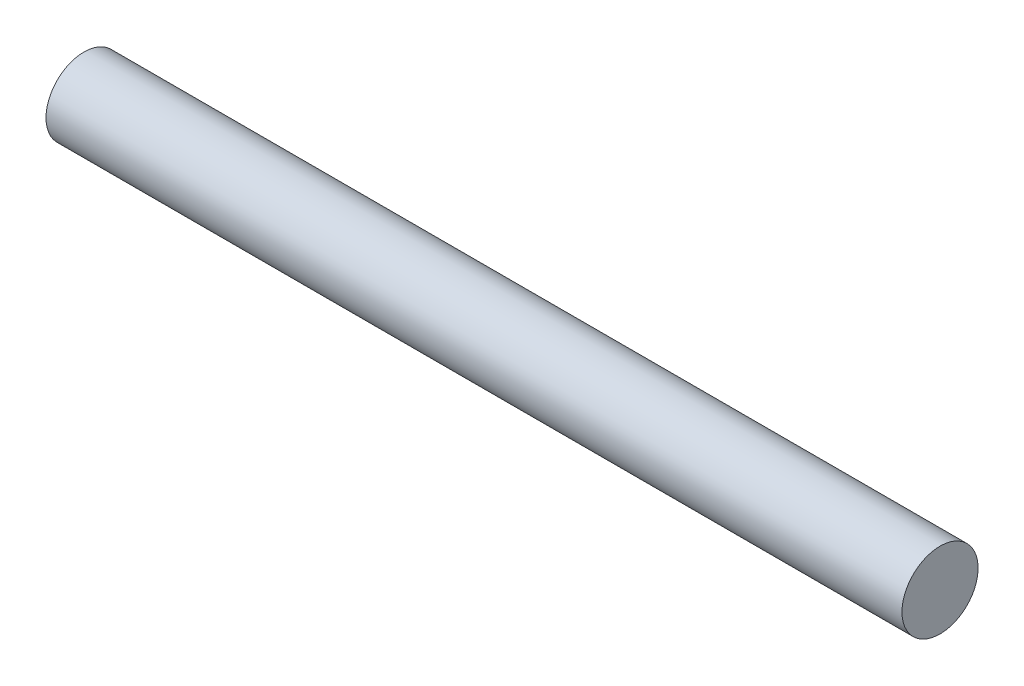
SolidWorks part; units mm, degrees
ref_plane "Face" through (0, 0, 0) normal (0, 0, 1) x (1, 0, 0)
ref_plane "Dessus" through (0, 0, 0) normal (0, 1, 0) x (1, 0, 0)
ref_plane "Droite" through (0, 0, 0) normal (1, 0, 0) x (0, 0, -1)
sketch "Esquisse1" plane through (0, 0, 0) normal (0, 0, 1) x (1, 0, 0)
  line L0 (225, 0) -> (-225, 0)
  line L1 (-225, 20) -> (225, 20)
  line L2 (-225, 20) -> (-225, 0)
  line L3 (-225, 0) -> (225, 0) construction
  line L4 (225, 20) -> (225, 0)
  dimension "D1" = 450
  dimension "D2" = 40
revolve "Révolution1" add sketch "Esquisse1" angle 360 about L3
